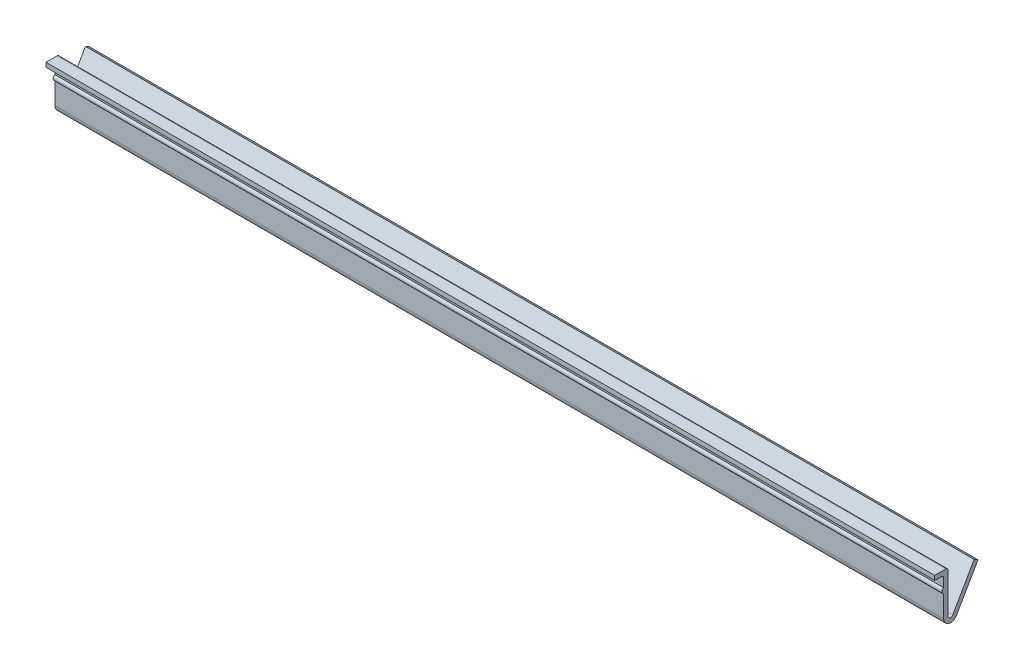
SolidWorks part; units mm, degrees
ref_plane "Front Plane" through (0, 0, 0) normal (0, 0, 1) x (1, 0, 0)
ref_plane "Top Plane" through (0, 0, 0) normal (0, 1, 0) x (1, 0, 0)
ref_plane "Right Plane" through (0, 0, 0) normal (1, 0, 0) x (0, 0, -1)
sketch3d "3DSketch1"
  line L0 (0, 0, 0) -> (200, 0, 0)
  dimension "D1" = 200
other "Asennuslistat 1.6001 ASENNUSLISTA 30(1)"
ref_plane "Plane1" through (0, 0, 0) normal (1, 0, 0) x (0, 0, -1)
sketch "Sketch1" plane through (0, 0, 0) normal (1, 0, 0) x (0, 0, -1)
  line L0 (-5.9435, 6.1176) -> (-3.4435, 6.1176)
  line L1 (-2.9435, 5.6176) -> (-2.9435, -3.3353)
  line L2 (-1.8864, -3.6172) -> (2.9322, 4.7774)
  line L3 (-5.9435, 5.1176) -> (-4.4435, 5.1176)
  line L4 (-3.9435, 4.6176) -> (-3.9435, 2.7174)
  line L5 (-1.0191, -4.115) -> (3.7995, 4.2796)
  line L6 (2.9322, 4.7774) -> (3.7995, 4.2796)
  line L7 (-5.9435, 6.1176) -> (-5.9435, 5.1176)
  line L8 (-5.9435, 5.1176) -> (-3.9435, 5.1176) construction
  line L9 (-3.9435, 5.1176) -> (-3.9435, -3.3353) construction
  line L10 (-5.9435, 6.1176) -> (-2.9435, 6.1176) construction
  line L11 (-2.9435, 6.1176) -> (-2.9435, -3.3353) construction
  line L12 (-3.9435, 1.5179) -> (-3.9435, -3.3353)
  arc A0 (-2.9435, -3.3353) -> (-1.8864, -3.6172) centre (-2.3774, -3.3353) ccw
  arc A1 (-3.9435, -3.3353) -> (-1.0191, -4.115) centre (-2.3774, -3.3353) ccw
  arc A2 (-4.4435, 5.1176) -> (-3.9435, 4.6176) centre (-4.4435, 4.6176) cw
  arc A3 (-3.4435, 6.1176) -> (-2.9435, 5.6176) centre (-3.4435, 5.6176) cw
  arc A4 (-3.9435, 2.7174) -> (-3.9435, 1.5179) centre (-3.6929, 2.1176) ccw
  point P5 (-2.5232, -3.8824)
  point P13 (0, 0)
  point P20 (-2.9435, 6.1176)
  dimension "D1" = 3
  dimension "D3" = 1
  dimension "D4" = 0.5
  dimension "D5" = 1.3
  dimension "D2" = 10
  dimension "D6" = 4
